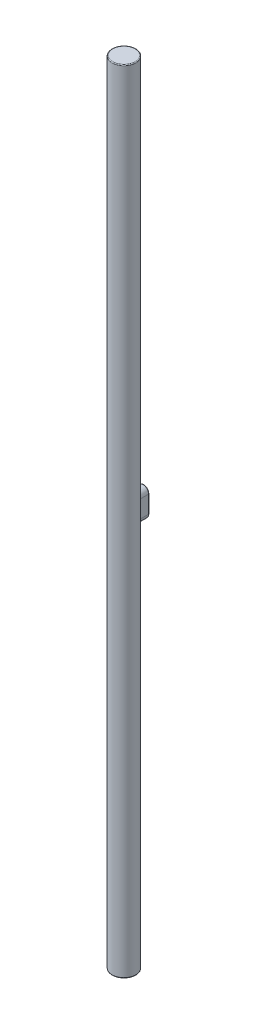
SolidWorks part; units mm, degrees
ref_plane "Alzado" through (0, 0, 0) normal (0, 0, 1) x (1, 0, 0)
ref_plane "Planta" through (0, 0, 0) normal (0, 1, 0) x (1, 0, 0)
ref_plane "Vista lateral" through (0, 0, 0) normal (1, 0, 0) x (0, 0, -1)
sketch "Croquis1" plane through (0, 0, 0) normal (0, 1, 0) x (1, 0, 0)
  circle A0 centre (0, 0) radius 15
  dimension "D1" = 30
extrude "Saliente-Extruir1" add sketch "Croquis1" along normal mid plane 1000
fillet "Redondeo1" radius 1 2 edges at (0, -500, 15) (0, 500, 15)
sketch "Croquis2" plane through (0, 0, 0) normal (0, 0, 1) x (1, 0, 0)
  line L0 (0, -11) -> (0, 11) construction
  line L1 (-7, -11) -> (-7, 11)
  line L2 (7, -11) -> (7, 11)
  arc A0 (-7, -11) -> (7, -11) centre (0, -11) ccw
  arc A1 (7, 11) -> (-7, 11) centre (0, 11) ccw
  point P2 (0, 0)
  dimension "D2" = 7
  dimension "D1" = 22
extrude "Saliente-Extruir2" add sketch "Croquis2" against normal blind 25
fillet "Redondeo2" radius 1 4 edges at (7, 0, -25) (0, -18, -25) (-7, 0, -25) (0, 18, -25)
